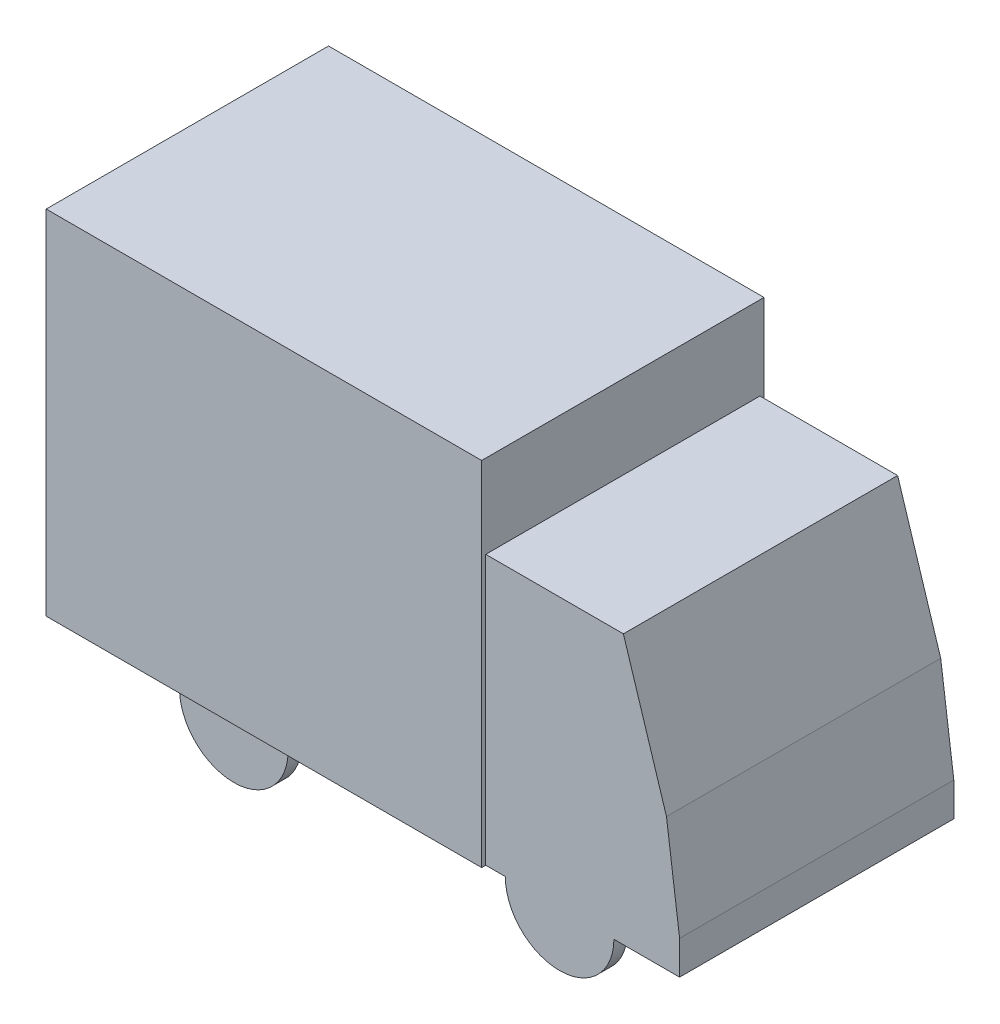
SolidWorks part; units mm, degrees
ref_plane "Plan de face" through (0, 0, 0) normal (0, 0, 1) x (1, 0, 0)
ref_plane "Plan de dessus" through (0, 0, 0) normal (0, 1, 0) x (1, 0, 0)
ref_plane "Plan de droite" through (0, 0, 0) normal (1, 0, 0) x (0, 0, -1)
ref_plane "Plan1" through (0, 0, -1200) normal (0, 0, 1) x (1, 0, 0)
sketch "Esquisse1" plane through (0, 0, -1200) normal (0, 0, 1) x (1, 0, 0)
  circle A0 centre (0, 0) radius 500
  circle A2 centre (-3000, 0) radius 500
  dimension "D1" = 1000
  dimension "D2" = 2
extrude "Boss.-Extru.1" add sketch "Esquisse1" along normal mid plane 125 contours A2 | A0
sketch "Esquisse3" plane through (0, 0, 0) normal (0, 0, 1) x (1, 0, 0)
  line L1 (587.4023, 2479.162) -> (984.0572, 1220.214)
  line L2 (984.0572, 1220.214) -> (1104.7782, 310.129)
  line L3 (1104.7782, 310.129) -> (1104.7782, 0)
  line L4 (1104.7782, 0) -> (-680.1685, 0)
  line L5 (-680.1685, 0) -> (-680.1685, 2479.162)
  line L6 (-680.1685, 2479.162) -> (587.4023, 2479.162)
extrude "Boss.-Extru.3" add sketch "Esquisse3" against normal up to surface (1262.5 mm away) contours L1 L2 L3 L4 L5 L6
sketch "Esquisse4" plane through (0, 0, 0) normal (0, 0, 1) x (1, 0, 0)
  line L1 (-4689.8316, 3246.6029) -> (-680.1685, 3246.6029)
  line L2 (-4689.8316, 3246.6029) -> (-4689.8316, 0)
  line L3 (-4689.8316, 0) -> (-680.1685, 0)
  line L4 (-680.1685, 3246.6029) -> (-680.1685, 0)
extrude "Boss.-Extru.4" add sketch "Esquisse4" against normal blind 1300
mirror "Symétrie1" about plane through (0, 0, 0) normal (0, 0, 1)
ref_plane "Plan2" through (4000, 0, 0) normal (1, 0, 0) x (0, 0, -1)
sketch "Esquisse5" plane through (4000, 0, 0) normal (1, 0, 0) x (0, 0, -1)
  line L0 (1137.5, -500) -> (1137.5, 0)
  line L1 (1137.5, -500) -> (1137.5, 0)
  line L2 (1137.5, 0) -> (-1137.5, 0)
  line L3 (1137.5, 0) -> (-1137.5, 0)
  line L4 (-1137.5, 0) -> (-1137.5, -500)
  line L5 (-1137.5, 0) -> (-1137.5, -500)
  line L6 (-1137.5, -500) -> (-1262.5, -500)
  line L7 (-1137.5, -500) -> (-1262.5, -500)
  line L8 (-1262.5, -500) -> (-1262.5, 0)
  line L9 (-1262.5, -500) -> (-1262.5, 0)
  line L10 (-1262.5, 0) -> (-1300, 0)
  line L11 (-1262.5, 0) -> (-1300, 0)
  line L12 (-1300, 0) -> (-1300, 3246.6029)
  line L13 (-1300, 0) -> (-1300, 3246.6029)
  line L14 (-1300, 3246.6029) -> (1300, 3246.6029)
  line L15 (-1300, 3246.6029) -> (1300, 3246.6029)
  line L16 (1300, 3246.6029) -> (1300, 0)
  line L17 (1300, 3246.6029) -> (1300, 0)
  line L18 (1300, 0) -> (1262.5, 0)
  line L19 (1300, 0) -> (1262.5, 0)
  line L20 (1262.5, 0) -> (1262.5, -500)
  line L21 (1262.5, 0) -> (1262.5, -500)
  line L22 (1262.5, -500) -> (1137.5, -500)
  line L23 (1262.5, -500) -> (1137.5, -500)
